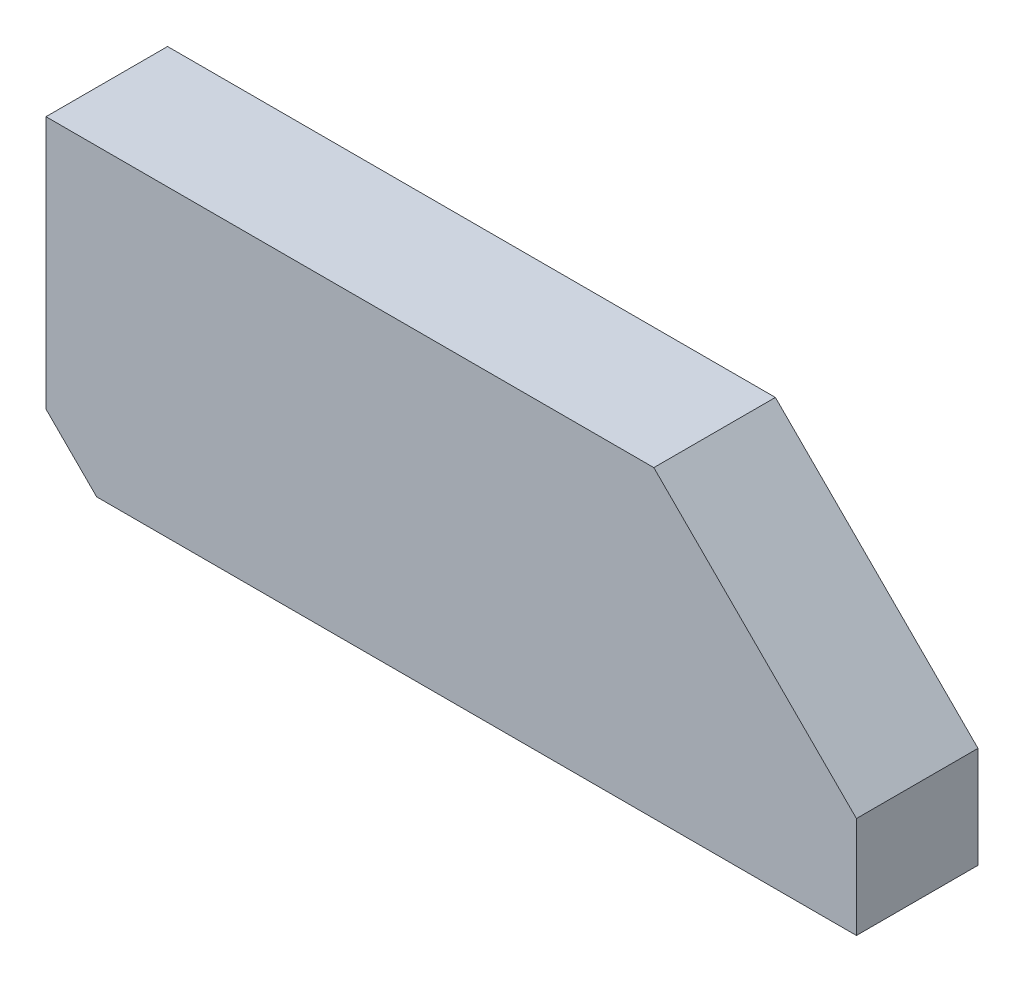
SolidWorks part; units mm, degrees
ref_plane "Face" through (0, 0, 0) normal (0, 0, 1) x (1, 0, 0)
ref_plane "Dessus" through (0, 0, 0) normal (0, 1, 0) x (1, 0, 0)
ref_plane "Droite" through (0, 0, 0) normal (1, 0, 0) x (0, 0, -1)
sketch "Esquisse1" plane through (0, 0, 0) normal (0, 0, 1) x (1, 0, 0)
  line L0 (60, 0) -> (80, -20)
  line L1 (0, 0) -> (60, 0)
  line L2 (0, 0) -> (0, -25)
  line L3 (5, -30) -> (80, -30)
  line L4 (80, -20) -> (80, -30)
  line L5 (0, -25) -> (5, -30)
  point P2 (0, -30)
  point P3 (80, 0)
  dimension "D1" = 80
  dimension "D2" = 30
  dimension "D5" = 20
  dimension "D6" = 5
extrude "Base-Extrusion" add sketch "Esquisse1" against normal blind 12
